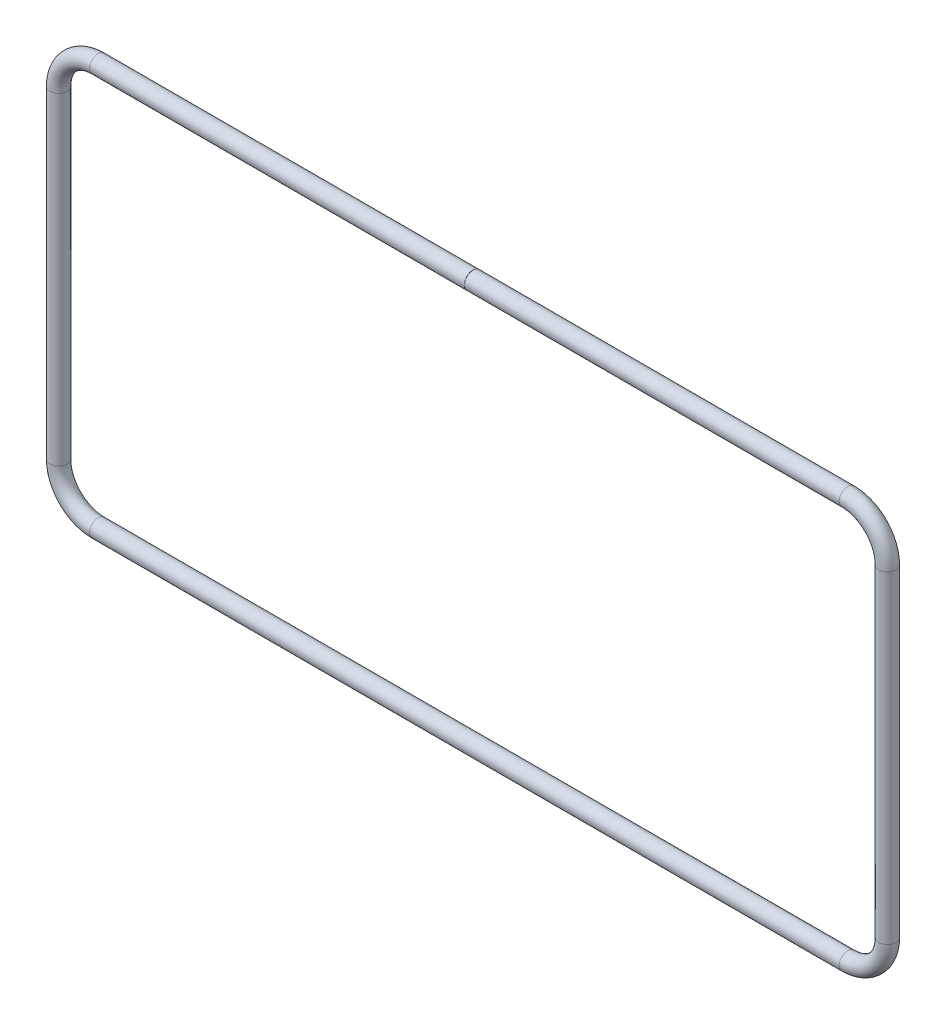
SolidWorks part; units mm, degrees
ref_plane "Front" through (0, 0, 0) normal (0, 0, 1) x (1, 0, 0)
ref_plane "Top" through (0, 0, 0) normal (0, 1, 0) x (1, 0, 0)
ref_plane "Right" through (0, 0, 0) normal (1, 0, 0) x (0, 0, -1)
sketch "Sketch1" plane through (0, 0, 0) normal (0, 0, 1) x (1, 0, 0)
  line L0 (0, 54.8909) -> (0, 43.9037) construction
  line L1 (-76.9493, 41.2623) -> (0, 41.2623)
  line L2 (-85.0773, 33.1343) -> (-85.0773, -33.1343)
  line L3 (-76.9493, -41.2623) -> (76.9493, -41.2623)
  line L4 (85.0773, 33.1343) -> (85.0773, -33.1343)
  line L5 (0.0254, 54.8909) -> (0.0254, 43.9037) construction
  line L6 (0.0254, 41.2623) -> (76.9493, 41.2623)
  arc A0 (-85.0773, 33.1343) -> (-76.9493, 41.2623) centre (-76.9493, 33.1343) cw
  arc A1 (85.0773, 33.1343) -> (76.9493, 41.2623) centre (76.9493, 33.1343) ccw
  arc A2 (76.9493, -41.2623) -> (85.0773, -33.1343) centre (76.9493, -33.1343) ccw
  arc A3 (-85.0773, -33.1343) -> (-76.9493, -41.2623) centre (-76.9493, -33.1343) ccw
  point P6 (-85.0773, 41.2623)
  point P12 (85.0773, -41.2623)
ref_plane "Plane1" through (0, 41.2623, 0) normal (1, 0, 0) x (0, 0, -1)
sketch "Sketch2" plane through (0, 41.2623, 0) normal (1, 0, 0) x (0, 0, -1)
  circle A0 centre (0, 0) radius 1.7653
  dimension "D1" = 3.5306
sweep "Base-Sweep" add profiles "Sketch2" path "Sketch1"
ref_plane "Plane2" through (0, 0, 1.7653) normal (0, 0, 1) x (1, 0, 0)
equation "\"D6@Sketch1\" = \"D2@Sketch1\"/2"
equation "\"D5@Sketch1\" = \"D1@Sketch1\" / 2"
